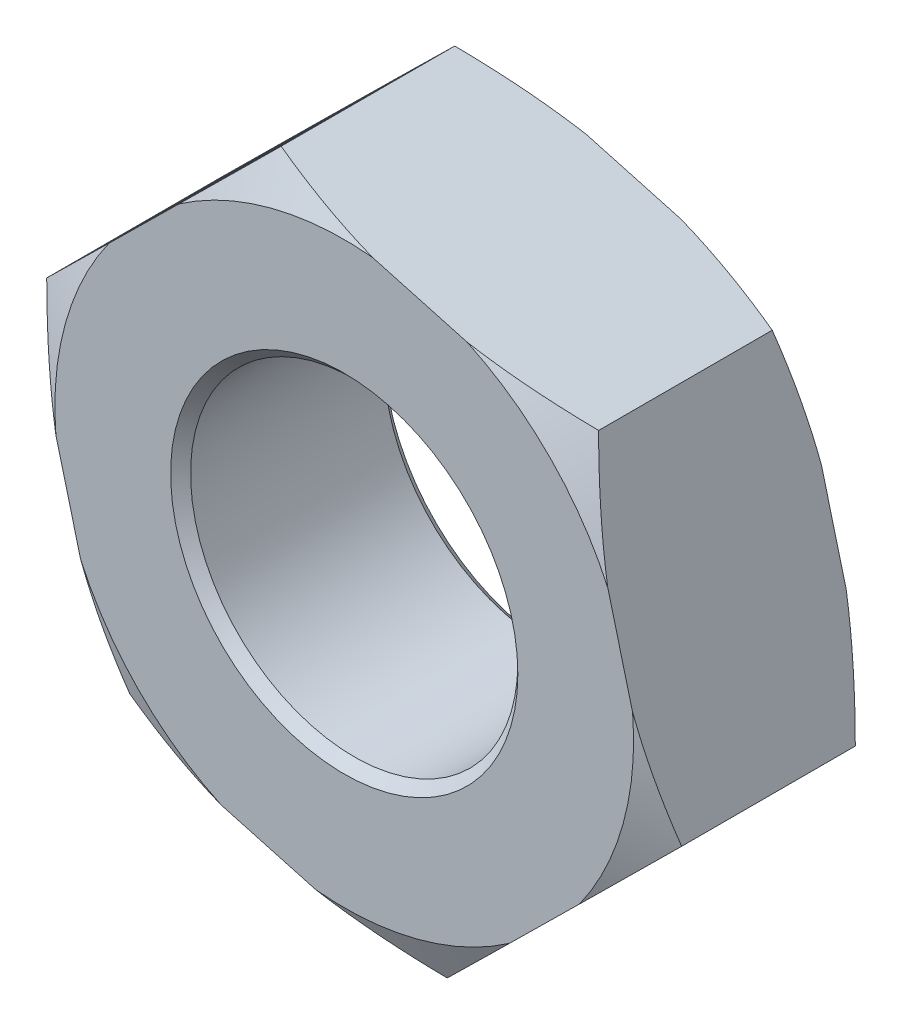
SolidWorks part; units mm, degrees
ref_plane "Front" through (0, 0, 0) normal (0, 0, 1) x (1, 0, 0)
ref_plane "Top" through (0, 0, 0) normal (0, 1, 0) x (1, 0, 0)
ref_plane "Right" through (0, 0, 0) normal (1, 0, 0) x (0, 0, -1)
sketch "Sketch1" plane through (0, 0, 0) normal (0, 0, 1) x (1, 0, 0)
  circle A0 centre (0, 0) radius 16.5
  dimension "D1" = 33
extrude "Base-Extrude" add sketch "Sketch1" along normal mid plane 10.7
sketch "Sketch2" plane through (0, 0, 5.35) normal (0, 0, 1) x (1, 0, 0)
  circle A0 centre (0, 0) radius 8.2
  dimension "D1" = 16.4
extrude "Cut-Extrude1" cut sketch "Sketch2" against normal through all
chamfer "Chamfer1" distance 1 distance2 2
chamfer "Chamfer2" distance 2 distance2 1
sketch "Sketch3" plane through (0, 0, 5.35) normal (0, 0, 1) x (1, 0, 0)
  line L1 (11.7469, 11.5871) -> (-4.1613, 15.9666)
  line L2 (-4.1613, 15.9666) -> (-15.9082, 4.3795)
  line L3 (-15.9082, 4.3795) -> (-11.7469, -11.5871)
  line L4 (-11.7469, -11.5871) -> (4.1613, -15.9666)
  line L5 (4.1613, -15.9666) -> (15.9082, -4.3795)
  line L6 (15.9082, -4.3795) -> (11.7469, 11.5871)
  circle A0 centre (0, 0) radius 14.2894 construction
  circle A1 centre (0, 0) radius 16.5 construction
  circle A2 centre (0, 0) radius 24.275
extrude "Cut-Extrude4" cut sketch "Sketch3" against normal through all
chamfer "Chamfer3" distance 0.5 angle 45
